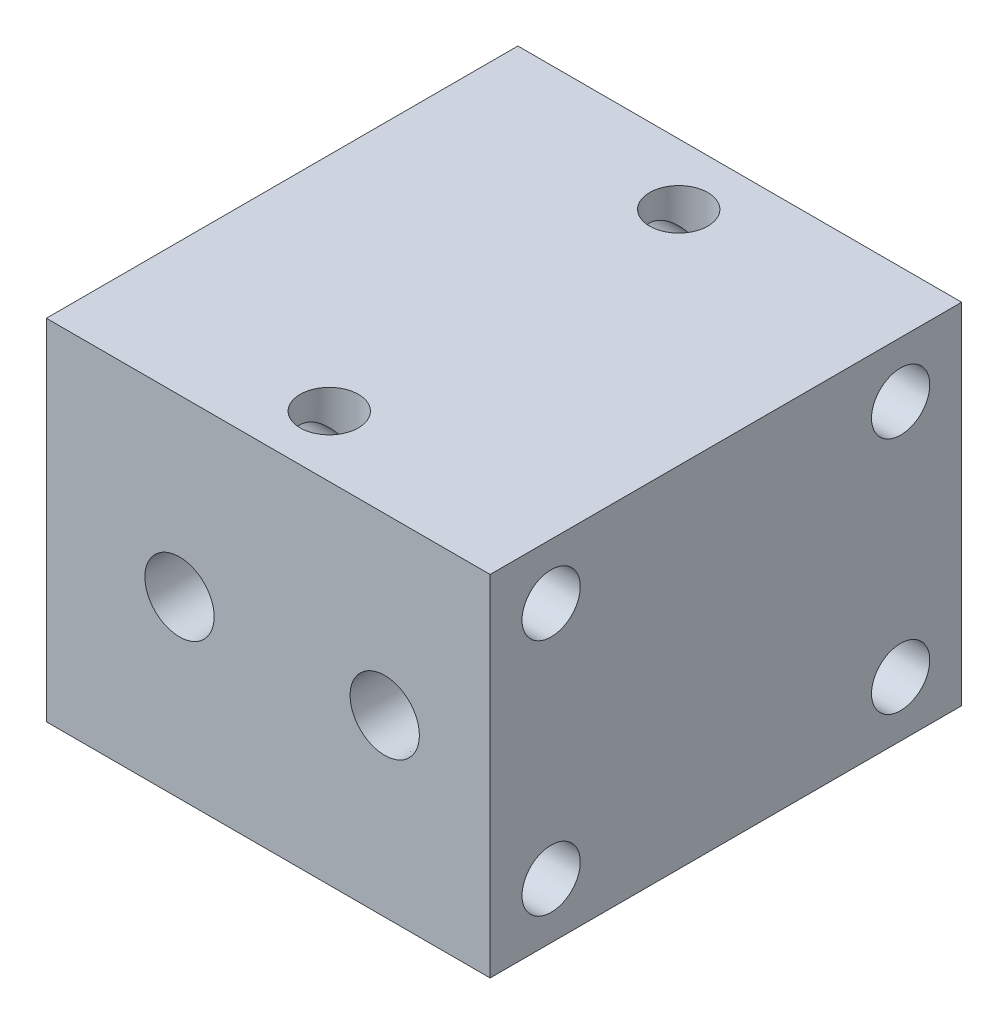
SolidWorks part; units mm, degrees
ref_plane "Front Plane" through (0, 0, 0) normal (0, 0, 1) x (1, 0, 0)
ref_plane "Top Plane" through (0, 0, 0) normal (0, 1, 0) x (1, 0, 0)
ref_plane "Right Plane" through (0, 0, 0) normal (1, 0, 0) x (0, 0, -1)
sketch "Sketch1" plane through (0, 0, 0) normal (0, 1, 0) x (1, 0, 0)
  line L0 (0, 31.5) -> (0, -31.5) construction
  line L1 (-40, 42.5) -> (40, 42.5)
  line L2 (-40, 42.5) -> (-40, -42.5)
  line L3 (-40, -42.5) -> (40, -42.5)
  line L4 (40, 42.5) -> (40, -42.5)
  line L5 (-40, 0) -> (0, 0) construction
  circle A0 centre (0, 31.5) radius 5.25
  circle A1 centre (0, -31.5) radius 5.25
  dimension "D5" = 10.5
  dimension "D6" = 10.5
  dimension "D8" = 40
  dimension "D1" = 85
  dimension "D2" = 42.5
  dimension "D3" = 80
  dimension "D4" = 40
  dimension "D7" = 63
extrude "H1" add sketch "Sketch1" along normal blind 63
sketch "Sketch2" plane through (-40, 0, 0) normal (-1, 0, 0) x (0, 0, 1)
  line L0 (0, 0) -> (0, 31.5) construction
  line L1 (42.5, 31.5) -> (0, 31.5) construction
  line L2 (42.5, 63) -> (42.5, 0) construction
  circle A0 centre (0, 31.5) radius 0.5
  dimension "D1" = 1
extrude "CENTER HOLE" cut sketch "Sketch2" against normal blind 60
hole_wizard "1/4 NPT Tapped Hole1" positions "Sketch4" profile "Sketch3" size "1/4" standard "Ansi Inch"
sketch "Sketch4" plane through (0, 0, 42.5) normal (0, 0, 1) x (1, 0, 0)
  line L0 (-40, 31.5) -> (40, 31.5) construction
  line L1 (-40, 63) -> (-40, 0) construction
  line L2 (40, 63) -> (40, 0) construction
  point P0 (21, 31.5)
  point P1 (-16, 31.5)
  dimension "D1" = 24
  dimension "D2" = 19
sketch "Sketch3" plane through (21, 31.5, 42.5) normal (1, 0, 0) x (0, -1, 0)
  line L0 (0, 0) -> (0, 20.4123)
  line L1 (5.5626, 17.07) -> (0, 20.4123)
  line L2 (-5.5626, 17.07) -> (0, 20.4123) construction
  line L3 (5.5626, 17.07) -> (5.5626, 10.02)
  line L4 (5.5626, 10.02) -> (5.9437, 10.02)
  line L5 (5.9437, 10.02) -> (6.2437, 0)
  line L6 (-5.9437, 10.02) -> (-6.2437, 0) construction
  line L7 (6.2437, 0) -> (0, 0)
  line L8 (0, -6.35) -> (0, 107.95) construction
  line L11 (-5.5626, 10.02) -> (-5.9437, 10.02) construction
  dimension "Tap Drill Dia." = 11.1252
  dimension "Tap Drill Depth" = 17.07
  dimension "Thread Dia." = 12.4874
  dimension "Thread Angle" = 3.43
  dimension "Thread Depth" = 10.02
  dimension "Drill Angle" = 118
sketch "Sketch6" plane through (-40, 0, 0) normal (-1, 0, 0) x (0, 0, 1)
  line L0 (-31.5, 63) -> (-31.5, 0) construction
  line L1 (31.5, 63) -> (31.5, 0) construction
  line L3 (-31.5, 53) -> (31.5, 53) construction
  line L5 (-31.5, 10) -> (31.5, 10) construction
  circle A0 centre (-31.5, 53) radius 5.25
  circle A1 centre (-31.5, 10) radius 5.25
  circle A2 centre (31.5, 53) radius 5.25
  circle A3 centre (31.5, 10) radius 5.25
  dimension "D3" = 10.5
  dimension "D1" = 21.5
  dimension "D2" = 43
extrude "MTG HOLE" cut sketch "Sketch6" against normal up to surface (80 mm away)
sketch "Sketch5" plane through (0, 0, 42.5) normal (0, 0, 1) x (1, 0, 0)
  circle A0 centre (-16, 31.5) radius 2
  circle A1 centre (21, 31.5) radius 2
  circle A2 centre (21, 31.5) radius 6.2437 construction
  circle A3 centre (-16, 31.5) radius 6.2437 construction
  dimension "D1" = 4
  dimension "D2" = 4
extrude "OIL HOLE" cut sketch "Sketch5" against normal blind 20
equation "\"D1@Sketch6\" = \"D2@Sketch6\" / 2"
equation "\"D5@Sketch1\" = \"D6@Sketch1\""
equation "\"D2@Sketch1\" = \"D1@Sketch1\"/2"
equation "\"D4@Sketch1\"=\"D3@Sketch1\" / 2"
